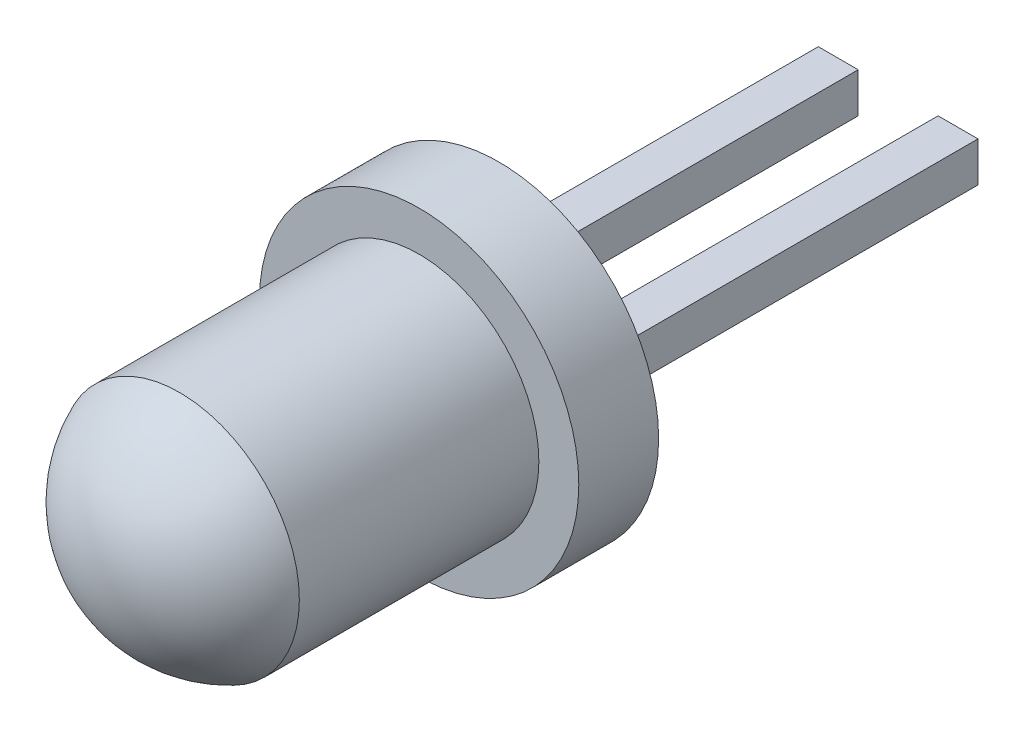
SolidWorks part; units mm, degrees
ref_plane "Face" through (0, 0, 0) normal (0, 0, 1) x (1, 0, 0)
ref_plane "Dessus" through (0, 0, 0) normal (0, 1, 0) x (1, 0, 0)
ref_plane "Droite" through (0, 0, 0) normal (1, 0, 0) x (0, 0, -1)
sketch "Esquisse1" plane through (0, 0, 0) normal (0, 0, 1) x (1, 0, 0)
  circle A0 centre (0, 0) radius 2
  dimension "D1" = 4
extrude "Cylindre de base" add sketch "Esquisse1" along normal mid plane 4
sketch "Esquisse2" plane through (-1.0657, -0.1013, 2) normal (0, 0, 1) x (1, 0, 0)
  line L0 (-0.2572, 1.6013) -> (2.3886, 1.6013) construction
  line L1 (-21.2532, 2.1013) -> (-18.6075, 2.1013) construction
  circle A1 centre (1.0657, 0.1013) radius 1.5
  circle A2 centre (1.0657, 0.1013) radius 2 construction
  dimension "D1" = 0.5
extrude "Enlèv. mat.-Extru.1" cut sketch "Esquisse2" against normal blind 3 flip side to cut
other "Chariotage1"
dome "Dôme1" faces to dome 1 distance 1 parameters "D1"=1
sketch "Esquisse3" plane through (0, 0, -2) normal (0, 0, -1) x (-1, 0, 0)
  line L0 (0.5, 0) -> (0, 0) construction
  line L1 (0.5, 0.25) -> (1, 0.25)
  line L2 (0.5, 0.25) -> (0.5, -0.25)
  line L3 (0.5, -0.25) -> (1, -0.25)
  line L4 (1, 0.25) -> (1, -0.25)
  dimension "D1" = 0.5
extrude "Extrusion1" add sketch "Esquisse3" along normal blind 5
mirror "Symétrie1" about plane through (0, 0, 0) normal (1, 0, 0)
